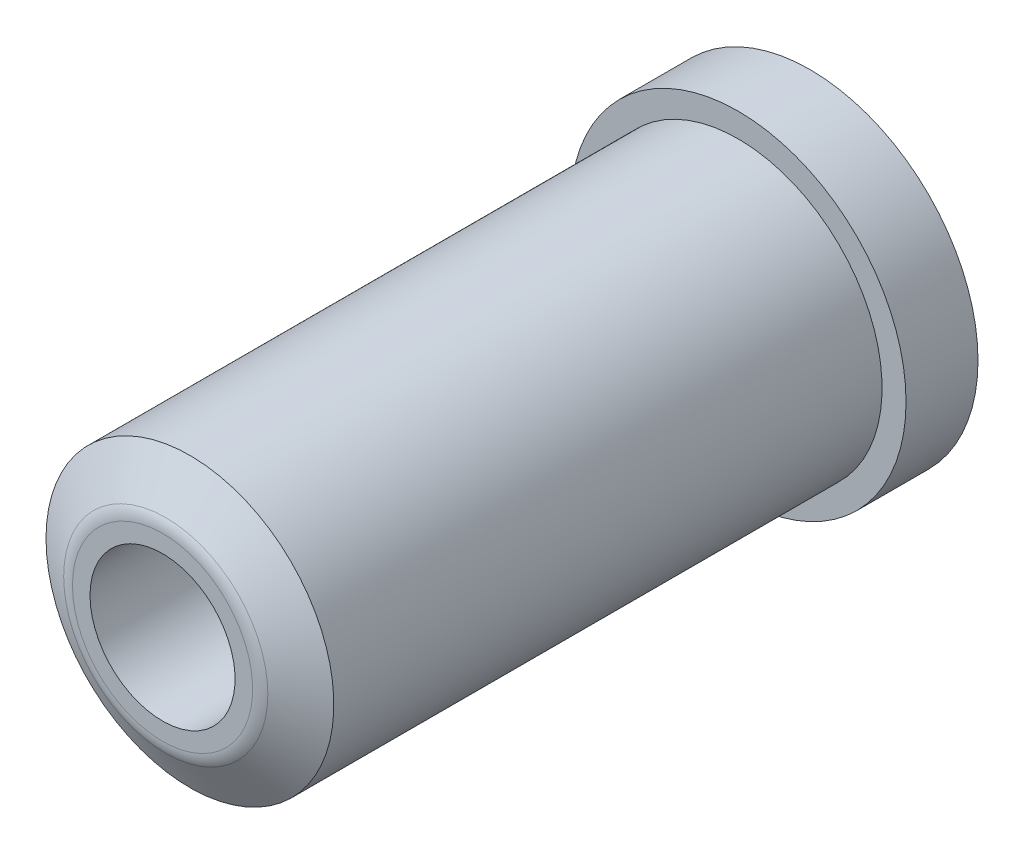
SolidWorks part; units mm, degrees
ref_plane "Front" through (0, 0, 0) normal (0, 0, 1) x (1, 0, 0)
ref_plane "Top" through (0, 0, 0) normal (0, 1, 0) x (1, 0, 0)
ref_plane "Right" through (0, 0, 0) normal (1, 0, 0) x (0, 0, -1)
sketch "Logo3_Revol_Axis" plane through (0, 0, 0) normal (0, 1, 0) x (1, 0, 0)
  line L0 (0, -30.1653) -> (0, 30.1653) construction
sketch "Logo3_bib1" plane through (0, 0, 0) normal (0, -1, 0) x (-1, 0, 0)
  line L0 (4.8006, 0) -> (4.8006, -39.6875)
  line L1 (4.8006, -42.8625) -> (5.9627, -42.8625)
  line L2 (9.525, -41.0514) -> (9.525, -4.7625)
  line L3 (9.525, -41.0514) -> (6.7565, -42.6498)
  line L4 (9.525, -4.7625) -> (11.1125, -4.7625)
  line L5 (11.1125, -4.7625) -> (11.1125, 0)
  line L8 (4.8006, -39.6875) -> (4.8006, -42.8625)
  line L9 (11.1125, 0) -> (4.8006, 0)
  line L10 (0, 41.5372) -> (0, -40.1764) construction
  arc A0 (6.7565, -42.6498) -> (5.9627, -42.8625) centre (5.9627, -41.275) cw
  point P7 (6.3881, -42.8625)
  dimension "D1" = 30
  dimension "D2" = 1.5875
  dimension "D3" = 1.8111
  dimension "D4" = 12.7762
  dimension "D5" = 1.5875
  dimension "logo3_d1" = 9.6012
  dimension "logo3_l1" = 42.8625
  dimension "logo3_d2" = 9.6012
  dimension "logo3_d3" = 19.05
  dimension "logo3_l2" = 3.175
  dimension "D6" = 1.5875
  dimension "D7" = 4.7625
  dimension "D8" = 38.1
revolve "Revolve1" add sketch "Logo3_bib1" angle 360 about L10
